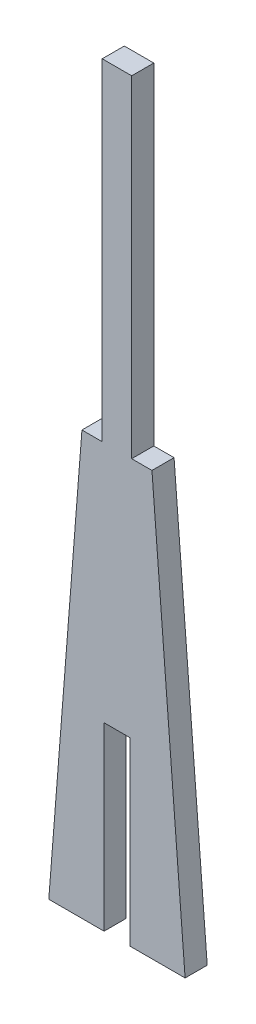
SolidWorks part; units mm, degrees
ref_plane "Alzado" through (0, 0, 0) normal (0, 0, 1) x (1, 0, 0)
ref_plane "Planta" through (0, 0, 0) normal (0, 1, 0) x (1, 0, 0)
ref_plane "Vista lateral" through (0, 0, 0) normal (1, 0, 0) x (0, 0, -1)
sketch "Sketch1" plane through (0, 0, 0) normal (0, 0, 1) x (1, 0, 0)
  line L0 (-9.25, 0) -> (9.25, 0)
  line L2 (-4.75, 57.4) -> (4.75, 57.4)
  line L3 (-4.75, 57.4) -> (-9.25, 0)
  line L4 (4.75, 57.4) -> (9.25, 0)
  line L5 (-1.75, 24.5) -> (1.75, 24.5)
  line L6 (-1.75, 24.5) -> (-1.75, 0)
  line L7 (1.75, 24.5) -> (1.75, 0)
  line L8 (-2, 102.4) -> (2, 102.4)
  line L9 (-2, 102.4) -> (-2, 57.4)
  line L10 (2, 102.4) -> (2, 57.4)
  point P4 (0, 0)
  point P10 (0, 57.4)
  point P12 (0, 24.5)
  point P17 (0, 102.4)
  dimension "D1" = 18.5
  dimension "D2" = 24.5
  dimension "D3" = 9.5
  dimension "D4" = 3.5
  dimension "D5" = 4.483
  dimension "D6" = 25.6223
  dimension "D7" = 57.4
  dimension "D8" = 45
  dimension "D9" = 4
  dimension "D10" = 2.75
extrude "Boss-Extrude1" add sketch "Sketch1" along normal blind 3 contours L5 L7 L0 L4 L2 L3 L6 | L10 L8 L9 L2
